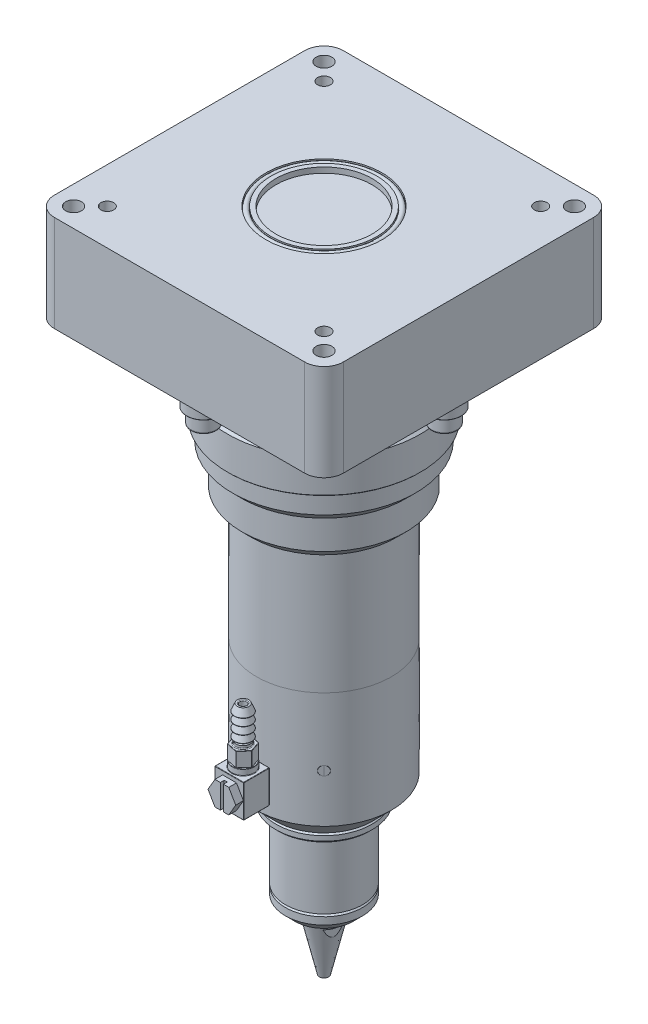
SolidWorks part; units mm, degrees
ref_plane "Front Plane" through (0, 0, 0) normal (0, 0, 1) x (1, 0, 0)
ref_plane "Top Plane" through (0, 0, 0) normal (0, 1, 0) x (1, 0, 0)
ref_plane "Right Plane" through (0, 0, 0) normal (1, 0, 0) x (0, 0, -1)
imported_body "Defeatured2"
hole_wizard "CBORE for M5 SHCS1" positions "Sketch1" profile "Sketch2" counterbore size "M5" standard "HAAS"
sketch "Sketch1" plane through (0, 0, 0) normal (0, -1, 0) x (-1, 0, 0)
  line L0 (0, 0) -> (59.0594, 0) construction
  line L2 (0, 0) -> (0, 76.2855) construction
  point P0 (-41.275, -41.275)
  point P12 (-41.275, 41.275)
  point P13 (41.275, 41.275)
  point P14 (41.275, -41.275)
  dimension "D1" = 41.275
  dimension "D2" = 41.275
sketch "Sketch2" plane through (41.275, 0, 41.275) normal (1, 0, 0) x (0, 0, -1)
  line L0 (0, 0) -> (0, 31.75)
  line L1 (0, 31.75) -> (2.6035, 31.75)
  line L3 (2.6035, 31.75) -> (2.6035, 5.334)
  line L4 (2.6035, 5.334) -> (4.3561, 5.334)
  line L5 (4.3561, 5.334) -> (4.3561, 0)
  line L7 (4.3561, 0) -> (0, 0)
  line L11 (0, -6.35) -> (0, 107.95) construction
  dimension "Thru Hole Dia." = 5.207
  dimension "Thru Hole Depth" = 31.75
  dimension "C'Bore Dia." = 8.7122
  dimension "C'Bore Depth" = 5.334
